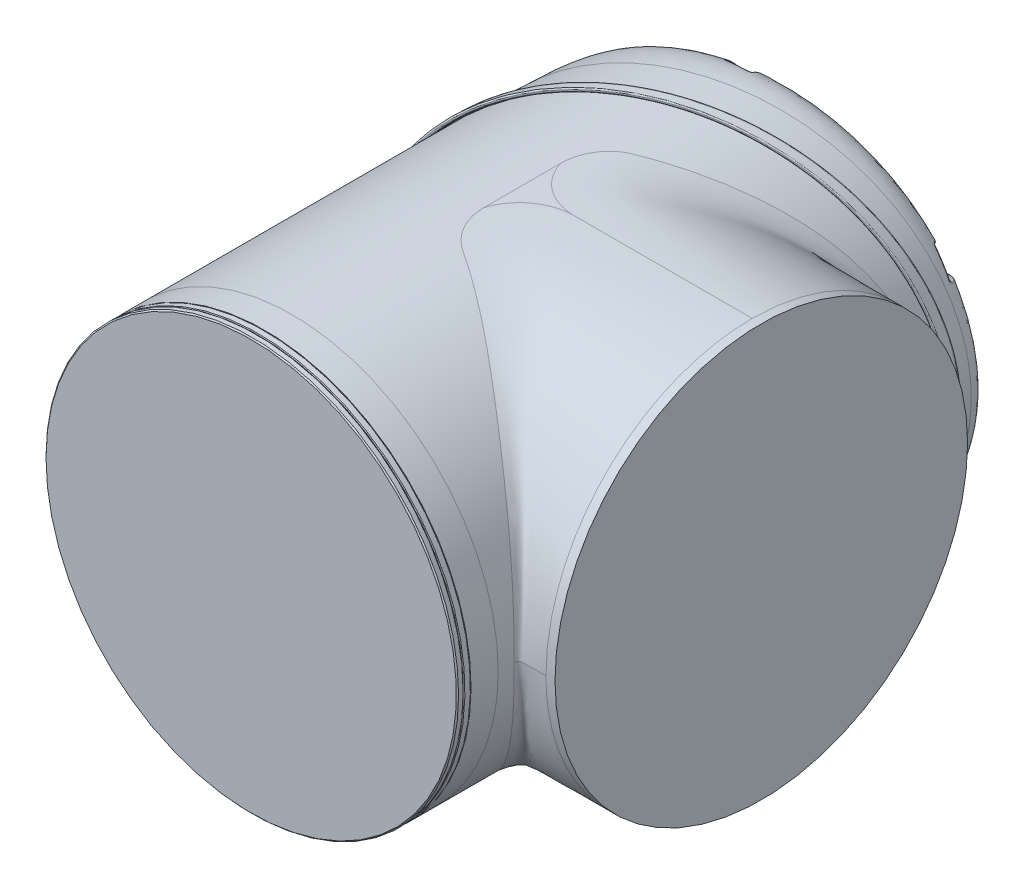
SolidWorks part; units mm, degrees
ref_plane "前视基准面" through (0, 0, 0) normal (0, 0, 1) x (1, 0, 0)
ref_plane "上视基准面" through (0, 0, 0) normal (0, 1, 0) x (1, 0, 0)
ref_plane "右视基准面" through (0, 0, 0) normal (1, 0, 0) x (0, 0, -1)
imported_body "40关节-1-solid1"
imported_body "40关节-1-surface1"
imported_body "40关节橡胶环-C-1-solid1"
delete or keep bodies "实体-删除/保留 1" type delete bodies bodies 107
